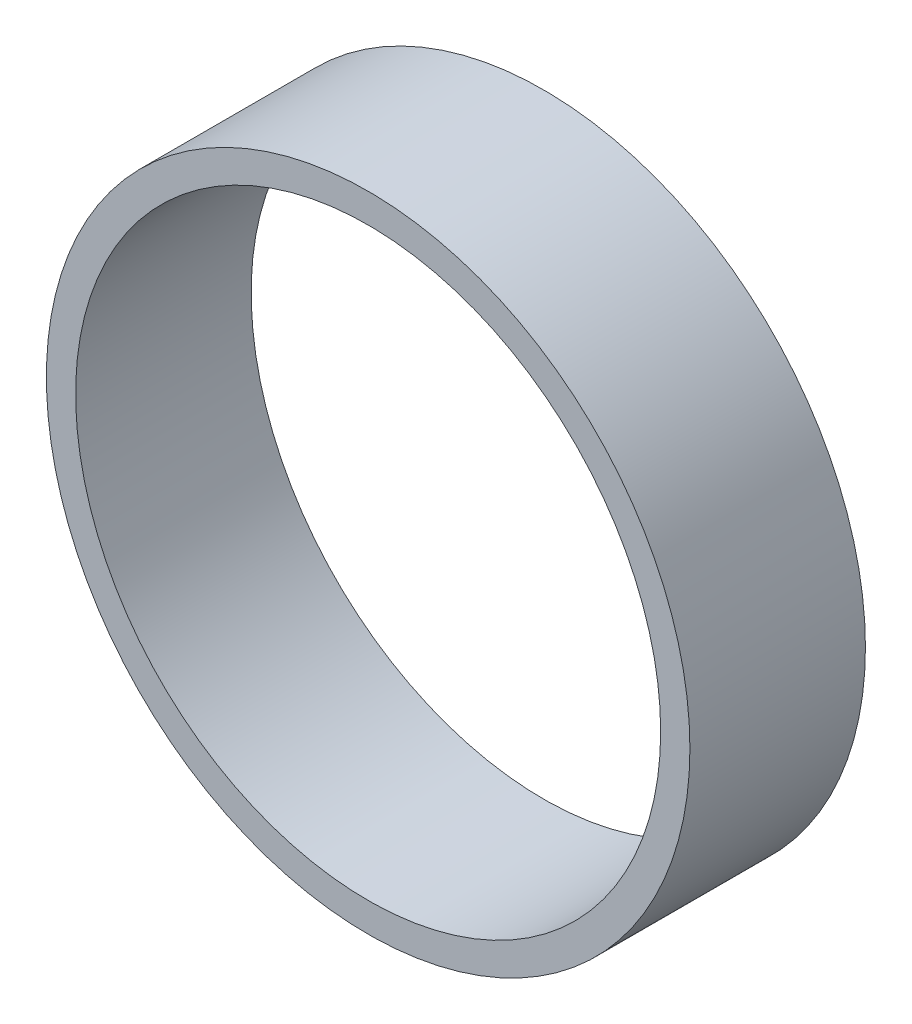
SolidWorks part; units mm, degrees
ref_plane "Plan de face" through (0, 0, 0) normal (0, 0, 1) x (1, 0, 0)
ref_plane "Plan de dessus" through (0, 0, 0) normal (0, 1, 0) x (1, 0, 0)
ref_plane "Plan de droite" through (0, 0, 0) normal (1, 0, 0) x (0, 0, -1)
sketch "Esquisse1" plane through (0, 0, 0) normal (0, 0, 1) x (1, 0, 0)
  circle A0 centre (0, 0) radius 25
  circle A1 centre (0, 0) radius 27.5
  dimension "D1" = 50
  dimension "D2" = 55
extrude "Extrusion1" add sketch "Esquisse1" along normal blind 15
